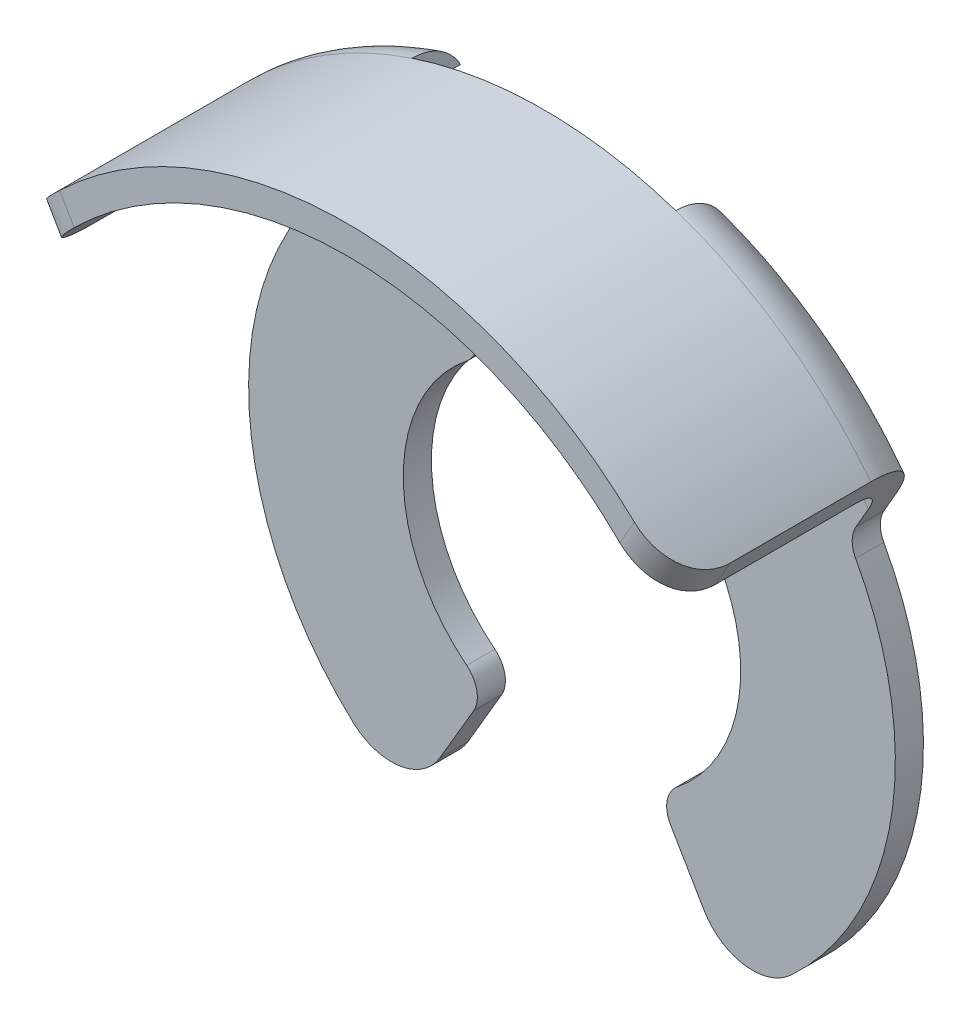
SolidWorks part; units mm, degrees
ref_plane "Front Plane" through (0, 0, 0) normal (0, 0, 1) x (1, 0, 0)
ref_plane "Top Plane" through (0, 0, 0) normal (0, 1, 0) x (1, 0, 0)
ref_plane "Right Plane" through (0, 0, 0) normal (1, 0, 0) x (0, 0, -1)
sketch "Sketch1" plane through (0, 0, 0) normal (0, 0, 1) x (1, 0, 0)
  circle A0 centre (0, 0) radius 3
  circle A1 centre (0, 0) radius 7.4
  dimension "D1" = 6
  dimension "D2" = 14.8
extrude "Boss-Extrude1" add sketch "Sketch1" against normal blind 4.5
sketch "Sketch2" plane through (0, 0, 0) normal (0, 0, 1) x (1, 0, 0)
  circle A0 centre (0, 0) radius 6.9
  dimension "D1" = 13.8
extrude "Cut-Extrude1" cut sketch "Sketch2" against normal blind 4
sketch "Sketch3" plane through (0, 0, 0) normal (0, 0, 1) x (1, 0, 0)
  line L0 (-5.8154, 4.5762) -> (-4.9054, 3)
  line L1 (5.8154, 4.5762) -> (4.9054, 3)
  circle A0 centre (0, 0) radius 7.4 construction
  arc A1 (-4.9054, 3) -> (4.9054, 3) centre (0, 0) ccw
  circle A2 centre (0, 0) radius 3 construction
  arc A4 (-5.8154, 4.5762) -> (5.8154, 4.5762) centre (0, 0) ccw
  point P7 (-5.75, 0)
  point P9 (5.75, 0)
  point P10 (0, 3)
  dimension "D1" = 60
  dimension "D2" = 11.5
extrude "Cut-Extrude2" cut sketch "Sketch3" against normal through all
sketch "Sketch4" plane through (0, 0, -4) normal (0, 0, 1) x (1, 0, 0)
  line L0 (0, 0) -> (-1.5174, -2.588) construction
  line L1 (0, 0) -> (1.5174, -2.588) construction
  line L2 (-1.5174, 2.588) -> (-2.941, 5.016)
  line L3 (0, 0) -> (-1.5174, 2.588) construction
  line L4 (0, 0) -> (1.5174, 2.588) construction
  line L5 (2.941, 5.016) -> (1.5174, 2.588)
  line L6 (1.5174, 2.588) -> (1.5174, -2.588) construction
  line L7 (-1.5174, 2.588) -> (-1.5174, -2.588) construction
  line L8 (-1.5174, -2.588) -> (-2.3487, -4.0058)
  line L9 (1.5174, -2.588) -> (2.3487, -4.0058)
  arc A0 (2.4306, 6.4577) -> (-2.4306, 6.4577) centre (0, 0) ccw
  arc A1 (5.5445, 4.1071) -> (-5.5445, 4.1071) centre (0, 0) ccw construction
  arc A2 (-1.5174, 2.588) -> (-1.5174, -2.588) centre (0, 0) ccw
  circle A3 centre (0, 0) radius 3 construction
  arc A4 (-2.941, 5.016) -> (-2.4306, 6.4577) centre (-2.0783, 5.5218) cw
  arc A6 (2.4306, 6.4577) -> (2.941, 5.016) centre (2.0783, 5.5218) cw
  arc A7 (-2.3487, -4.0058) -> (-3.8874, -4.2368) centre (-3.2113, -3.5) cw
  arc A8 (-4.9054, 3) -> (4.9054, 3) centre (0, 0) ccw construction
  arc A9 (2.3487, -4.0058) -> (3.8874, -4.2368) centre (3.2113, -3.5) ccw
  arc A10 (3.8874, -4.2368) -> (-3.8874, -4.2368) centre (0, 0) cw
  arc A11 (5.8154, 4.5762) -> (-5.8154, 4.5762) centre (0, 0) ccw construction
  arc A12 (1.5174, -2.588) -> (1.5174, 2.588) centre (0, 0) ccw
  point P1 (-3.2113, -4.5)
  point P30 (3.2113, -4.5)
  point P31 (0, 7.4)
  dimension "D2" = 1
  dimension "D1" = 11.9
extrude "Cut-Extrude3" cut sketch "Sketch4" against normal up to vertex
fillet "Fillet1" radius 1 3 edges at (0, 7.4, -4.5) (5.6799, 4.3416, 0) (-5.6799, 4.3416, 0)
fillet "Fillet2" radius 0.5 8 edges at (4.1572, 5.5071, -4) (-4.1572, 5.5071, -4) (-1.5174, -2.588, -4.25) (1.5174, -2.588, -4.25) (-1.5174, 2.588, -4.25) (1.5174, 2.588, -4.25) (-4.9054, 3, -4.25) (4.9054, 3, -4.25)
sketch "Sketch5" plane through (0, -4.5, -4.5) normal (0, 0, 1) x (1, 0, 0)
  line L0 (-2.3465, 8.5022) -> (-2.3465, 11.9)
  line L5 (2.3465, 8.5022) -> (2.3465, 11.9)
  line L6 (2.3465, 8.5022) -> (-2.3465, 8.5022)
  line L7 (1.7521, 7.4883) -> (2.941, 9.516) construction
  line L8 (-2.941, 9.516) -> (-1.7521, 7.4883) construction
  line L10 (-2.3465, 11.9) -> (2.3465, 11.9)
  arc A0 (5.8154, 9.0762) -> (-5.8154, 9.0762) centre (0, 4.5) ccw construction
extrude "Cut-Extrude5" cut sketch "Sketch5" along normal blind 1
